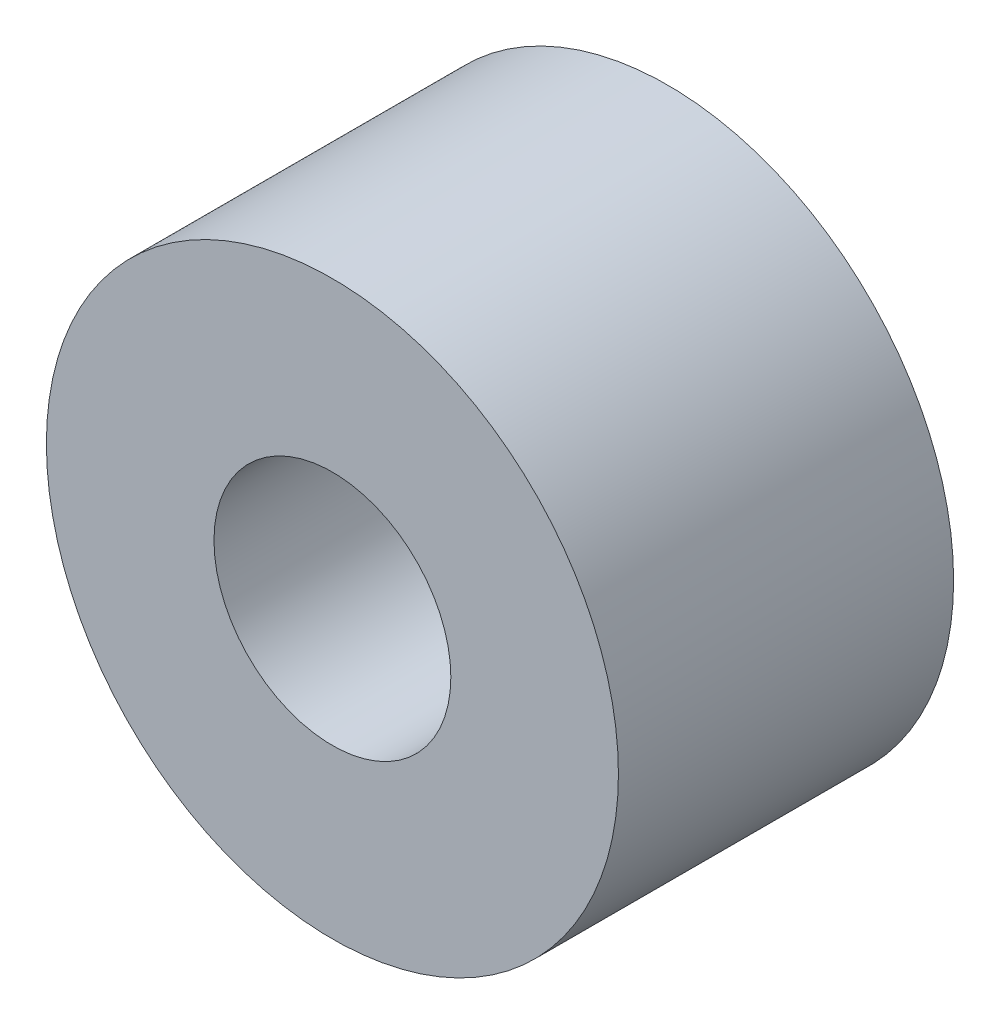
SolidWorks part; units mm, degrees
ref_plane "Front Plane" through (0, 0, 0) normal (0, 0, 1) x (1, 0, 0)
ref_plane "Top Plane" through (0, 0, 0) normal (0, 1, 0) x (1, 0, 0)
ref_plane "Right Plane" through (0, 0, 0) normal (1, 0, 0) x (0, 0, -1)
sketch "Sketch1" plane through (0, 0, 0) normal (0, 0, 1) x (1, 0, 0)
  circle A0 centre (-23.7396, 12.7425) radius 8.128
  circle A1 centre (-23.7396, 12.7425) radius 3.3655
  dimension "D1" = 16.256
  dimension "D2" = 6.731
extrude "Boss-Extrude1" add sketch "Sketch1" along normal blind 9.525
